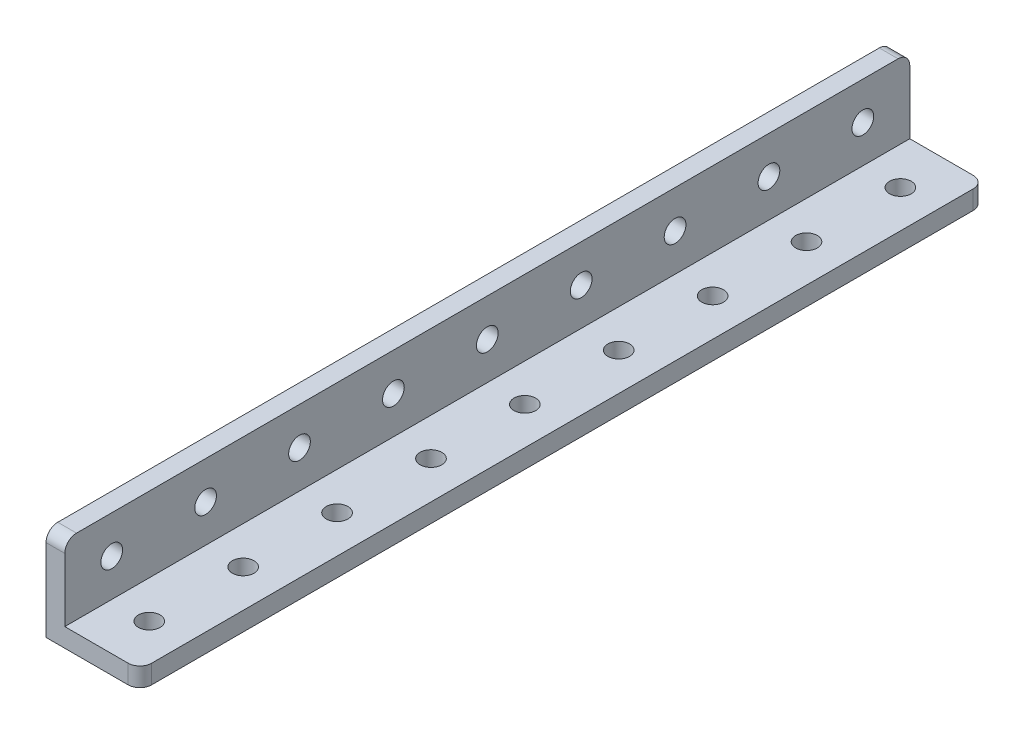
SolidWorks part; units mm, degrees
ref_plane "Front Plane" through (0, 0, 0) normal (0, 0, 1) x (1, 0, 0)
ref_plane "Top Plane" through (0, 0, 0) normal (0, 1, 0) x (1, 0, 0)
ref_plane "Right Plane" through (0, 0, 0) normal (1, 0, 0) x (0, 0, -1)
sketch "Sketch1" plane through (0, 0, 0) normal (0, 0, 1) x (1, 0, 0)
  line L0 (0, 0) -> (16, 0)
  line L1 (16, 0) -> (16, 3.2)
  line L2 (16, 3.2) -> (3.2, 3.2)
  line L3 (3.2, 3.2) -> (3.2, 16)
  line L4 (3.2, 16) -> (0, 16)
  line L5 (0, 16) -> (0, 0)
  dimension "D1" = 16
  dimension "D2" = 3.2
  dimension "D3" = 16
  dimension "D4" = 3.2
extrude "Extrude1" add sketch "Sketch1" against normal blind 144
sketch "Sketch2"
sketch_block_instance "Block2-1"
sketch_block "Block2" parameters "D1"=3.7, "D2"=16, "D3"=16, "D4"=16, "D5"=16, "D6"=16, "D7"=16, "D8"=16, "D9"=16, "D10"=16, "D11"=16, "D12"=16, "D13"=16, "D14"=16
extrude "Cut-Extrude1" cut sketch "Sketch2" against normal through all
sketch "Sketch3" plane through (0, 0, 0) normal (0, -1, 0) x (1, 0, 0)
  line L0 (0, -144) -> (16, -144) construction
  line L1 (16, -144) -> (16, 0) construction
  dimension "D1" = 8
  dimension "D2" = 6.4
sketch_block_instance "Block2-2"
extrude "Cut-Extrude2" cut sketch "Sketch3" against normal through all
fillet "Fillet1" radius 2 1 edges at (1.6, 16, 0)
fillet "Fillet2" radius 2 1 edges at (16, 1.6, 0)
fillet "Fillet3" radius 2 1 edges at (1.6, 16, -144)
fillet "Fillet4" radius 2 1 edges at (16, 1.6, -144)
